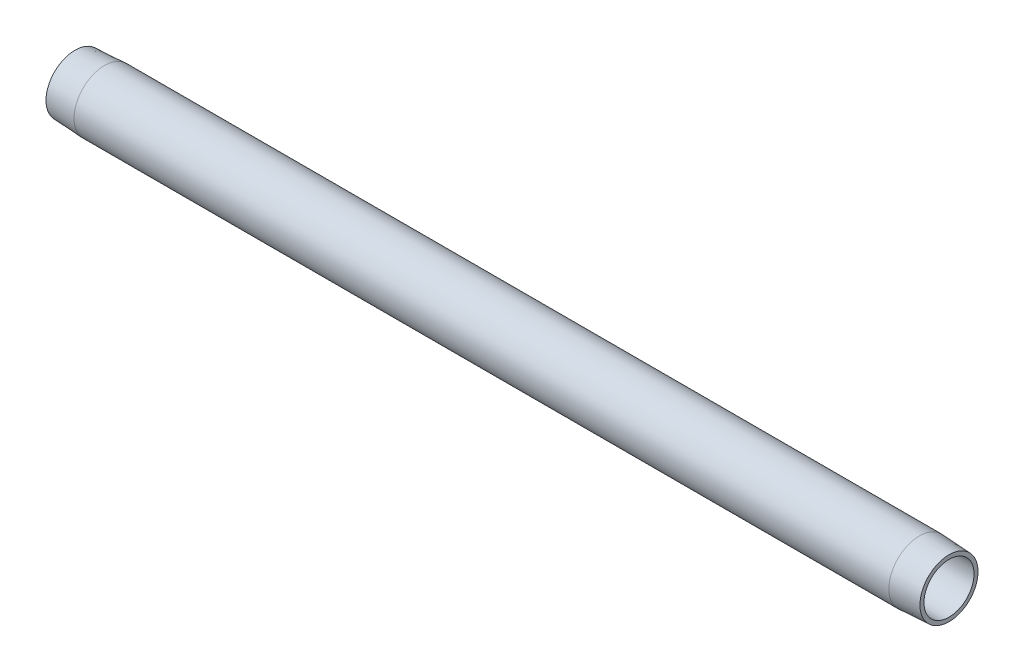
SolidWorks part; units mm, degrees
ref_plane "Front Plane" through (0, 0, 0) normal (0, 0, 1) x (1, 0, 0)
ref_plane "Top Plane" through (0, 0, 0) normal (0, 1, 0) x (1, 0, 0)
ref_plane "Right Plane" through (0, 0, 0) normal (1, 0, 0) x (0, 0, -1)
sketch "Sketch1" plane through (0, 0, 0) normal (0, 0, 1) x (1, 0, 0)
  line L6 (304.8, 8.7313) -> (0, 8.7313)
  line L7 (10.3124, 10.668) -> (0, 10.1276)
  line L8 (294.4876, 10.668) -> (10.3124, 10.668)
  line L9 (304.8, 10.1276) -> (294.4876, 10.668)
  line L10 (304.8, 8.7313) -> (304.8, 10.1276)
  line L11 (0, 10.1276) -> (0, 8.7313)
  line L12 (0, 0) -> (50000, 0) construction
  line L13 (0, -55) -> (0, 55) construction
  dimension "D1" = 304.8
  dimension "D2" = 3
  dimension "D3" = 3
  dimension "D4" = 21.336
  dimension "D5" = 17.4625
  dimension "D6" = 10.3124
  dimension "D7" = 10.3124
revolve "Revolve1" add sketch "Sketch1" angle 360 about L12
